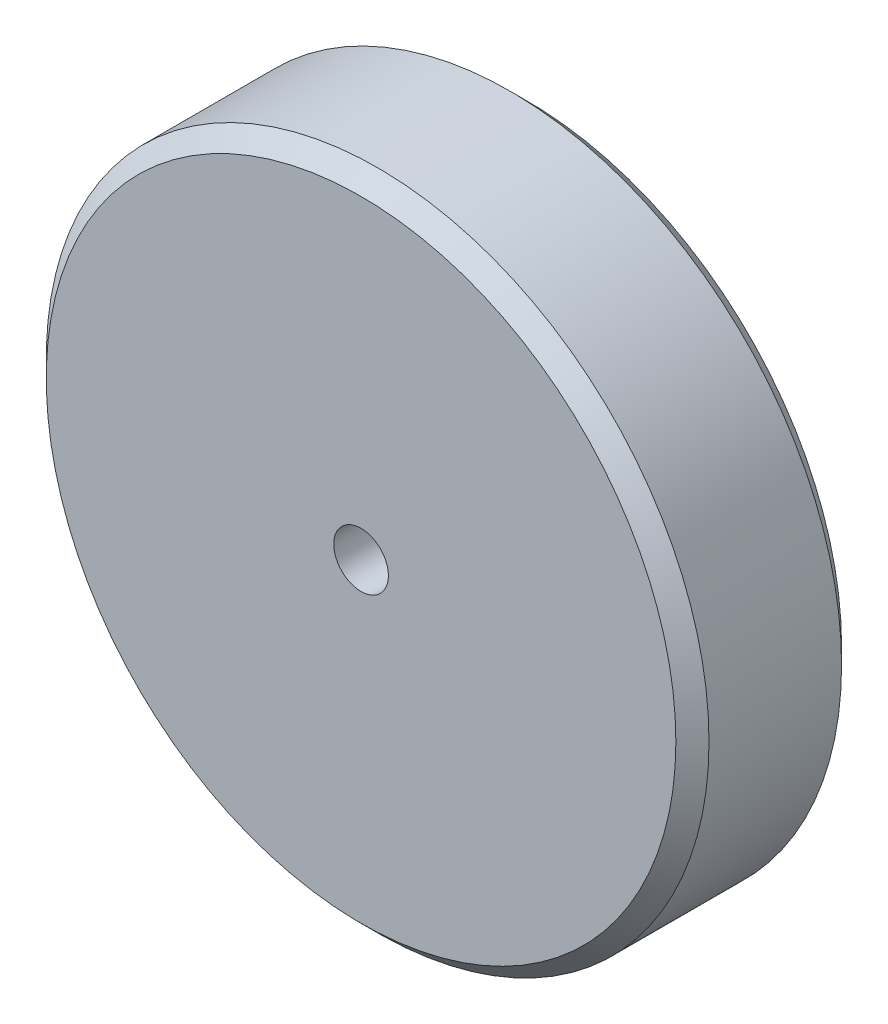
SolidWorks part; units mm, degrees
ref_plane "Front Plane" through (0, 0, 0) normal (0, 0, 1) x (1, 0, 0)
ref_plane "Top Plane" through (0, 0, 0) normal (0, 1, 0) x (1, 0, 0)
ref_plane "Right Plane" through (0, 0, 0) normal (1, 0, 0) x (0, 0, -1)
sketch "Sketch1" plane through (0, 0, 0) normal (0, 0, 1) x (1, 0, 0)
  circle A0 centre (0, 0) radius 20
  dimension "D1" = 40
extrude "Extrude1" add sketch "Sketch1" along normal blind 10
hole_wizard "M4 Tapped Hole1" positions "3DSketch1" profile "Sketch2" tap size "M4" standard "ISO"
sketch3d "3DSketch1"
  line L0 (0, 0, 10) -> (0, 0, 0) construction
  point P0 (0, 0, 0)
  point P4 (0, 0, 10)
sketch "Sketch2" plane through (0, 0, 10) normal (1, 0, 0) x (0, -1, 0)
  line L0 (0, 0) -> (0, 10)
  line L1 (0, 10) -> (1.65, 10)
  line L2 (1.65, 10) -> (1.65, 0)
  line L5 (1.65, 0) -> (0, 0)
  line L11 (0, -6.35) -> (0, 107.95) construction
  dimension "Thru Tap Drill Dia." = 3.3
  dimension "Thru Tap Drill Depth" = 10
chamfer "Chamfer1" distance 1 angle 45 2 edges at (20, 0, 0) (20, 0, 10)
